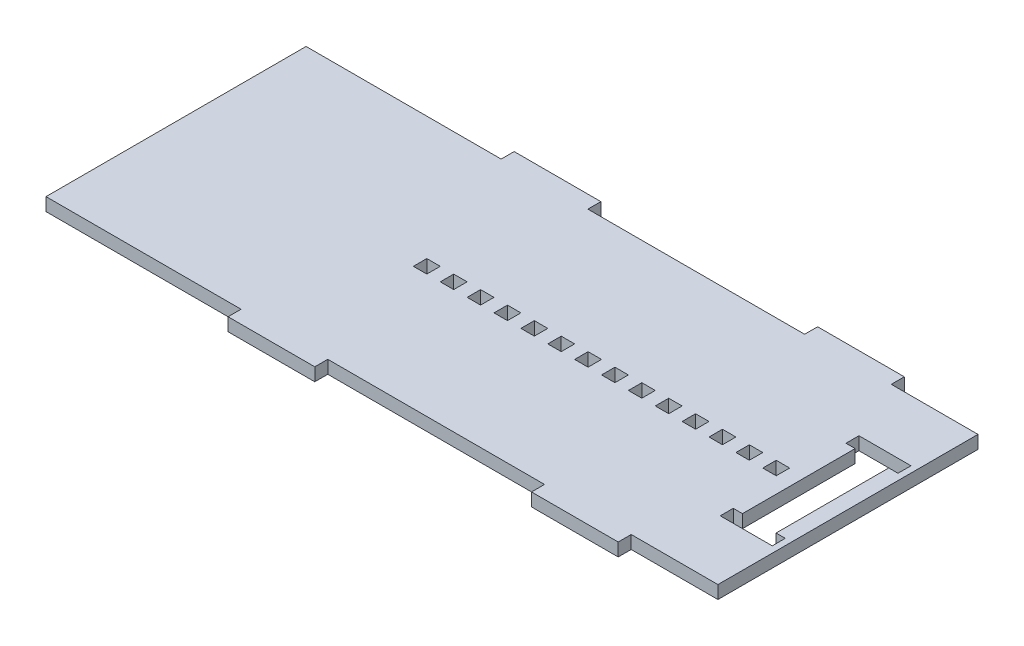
SolidWorks part; units mm, degrees
ref_plane "Front Plane" through (0, 0, 0) normal (0, 0, 1) x (1, 0, 0)
ref_plane "Top Plane" through (0, 0, 0) normal (0, 1, 0) x (1, 0, 0)
ref_plane "Right Plane" through (0, 0, 0) normal (1, 0, 0) x (0, 0, -1)
sketch "Sketch1" plane through (0, 0, 0) normal (0, 1, 0) x (1, 0, 0)
  line L1 (-65, 30) -> (65, 30)
  line L2 (-65, 30) -> (-65, -30)
  line L3 (-65, -30) -> (65, -30)
  line L4 (65, 30) -> (65, -30)
  line L5 (-65, 30) -> (65, -30) construction
  line L6 (-65, -30) -> (65, 30) construction
  point P0 (0, 0)
  dimension "D1" = 60
  dimension "D2" = 130
extrude "Boss-Extrude1" add sketch "Sketch1" along normal blind 3
sketch "Sketch2" plane through (0, 0, 0) normal (0, 1, 0) x (1, 0, 0)
  line L0 (35, 30) -> (35, 31.5) construction
  line L1 (65, 30) -> (-65, 30) construction
  line L2 (65, -30) -> (65, 30) construction
  line L3 (25, 33) -> (45, 33)
  line L4 (25, 33) -> (25, 30)
  line L5 (25, 30) -> (45, 30)
  line L6 (45, 33) -> (45, 30)
  line L7 (25, 33) -> (45, 30) construction
  line L8 (25, 30) -> (45, 33) construction
  line L9 (-35, 30) -> (-35, 31.5) construction
  line L10 (0, 0) -> (10.9135, 0) construction
  line L11 (-45, 33) -> (-25, 33)
  line L12 (-45, 33) -> (-45, 30)
  line L13 (-45, 30) -> (-25, 30)
  line L14 (-25, 33) -> (-25, 30)
  line L15 (-45, 33) -> (-25, 30) construction
  line L16 (-45, 30) -> (-25, 33) construction
  line L17 (-45, -30) -> (-25, -33) construction
  line L18 (-45, -33) -> (-25, -30) construction
  line L19 (-35, -30) -> (-35, -31.5) construction
  line L20 (25, -30) -> (45, -33) construction
  line L21 (25, -33) -> (45, -30) construction
  line L22 (35, -30) -> (35, -31.5) construction
  line L23 (-25, -33) -> (-25, -30)
  line L24 (-45, -30) -> (-25, -30)
  line L25 (-45, -33) -> (-45, -30)
  line L26 (-45, -33) -> (-25, -33)
  line L27 (45, -33) -> (45, -30)
  line L28 (25, -30) -> (45, -30)
  line L29 (25, -33) -> (25, -30)
  line L30 (25, -33) -> (45, -33)
  dimension "D1" = 20
  dimension "D2" = 3
  dimension "D3" = 20
  dimension "D4" = 50
extrude "Boss-Extrude2" add sketch "Sketch2" along normal blind 3
sketch "Sketch3" plane through (0, 0, 0) normal (0, 1, 0) x (1, 0, 0)
  line L0 (-65, 30) -> (-65, -30)
  line L1 (-65, 30) -> (-90, 30)
  line L2 (-65, -30) -> (-90, -30)
  line L3 (-90, 30) -> (-90, -30)
  dimension "D1" = 25
extrude "Boss-Extrude3" add sketch "Sketch3" along normal blind 3
sketch "Sketch4" plane through (0, 0, 0) normal (0, 1, 0) x (1, 0, 0)
  line L0 (-90, 0) -> (65, 0) construction
  line L1 (-90, 30) -> (-90, -30) construction
  line L2 (65, -30) -> (65, 30) construction
  line L3 (40.7, 1.55) -> (43.8, 1.55)
  line L4 (46.9, 1.55) -> (50, 1.55)
  line L5 (46.9, 1.55) -> (46.9, -1.55)
  line L6 (46.9, -1.55) -> (50, -1.55)
  line L7 (50, 1.55) -> (50, -1.55)
  line L8 (46.9, 1.55) -> (50, -1.55) construction
  line L9 (46.9, -1.55) -> (50, 1.55) construction
  line L10 (40.7, 1.55) -> (40.7, -1.55)
  line L11 (40.7, -1.55) -> (43.8, -1.55)
  line L12 (43.8, 1.55) -> (43.8, -1.55)
  line L13 (40.7, 1.55) -> (43.8, -1.55) construction
  line L14 (40.7, -1.55) -> (43.8, 1.55) construction
  line L15 (34.5, 1.55) -> (37.6, 1.55)
  line L16 (34.5, 1.55) -> (34.5, -1.55)
  line L17 (34.5, -1.55) -> (37.6, -1.55)
  line L18 (37.6, 1.55) -> (37.6, -1.55)
  line L19 (34.5, 1.55) -> (37.6, -1.55) construction
  line L20 (34.5, -1.55) -> (37.6, 1.55) construction
  line L21 (28.3, 1.55) -> (31.4, 1.55)
  line L22 (28.3, 1.55) -> (28.3, -1.55)
  line L23 (28.3, -1.55) -> (31.4, -1.55)
  line L24 (31.4, 1.55) -> (31.4, -1.55)
  line L25 (28.3, 1.55) -> (31.4, -1.55) construction
  line L26 (28.3, -1.55) -> (31.4, 1.55) construction
  line L27 (22.1, 1.55) -> (25.2, 1.55)
  line L28 (22.1, 1.55) -> (22.1, -1.55)
  line L29 (22.1, -1.55) -> (25.2, -1.55)
  line L30 (25.2, 1.55) -> (25.2, -1.55)
  line L31 (22.1, 1.55) -> (25.2, -1.55) construction
  line L32 (22.1, -1.55) -> (25.2, 1.55) construction
  line L33 (15.9, 1.55) -> (19, 1.55)
  line L34 (15.9, 1.55) -> (15.9, -1.55)
  line L35 (15.9, -1.55) -> (19, -1.55)
  line L36 (19, 1.55) -> (19, -1.55)
  line L37 (15.9, 1.55) -> (19, -1.55) construction
  line L38 (15.9, -1.55) -> (19, 1.55) construction
  line L39 (9.7, 1.55) -> (12.8, 1.55)
  line L40 (9.7, 1.55) -> (9.7, -1.55)
  line L41 (9.7, -1.55) -> (12.8, -1.55)
  line L42 (12.8, 1.55) -> (12.8, -1.55)
  line L43 (9.7, 1.55) -> (12.8, -1.55) construction
  line L44 (9.7, -1.55) -> (12.8, 1.55) construction
  line L45 (3.5, 1.55) -> (6.6, 1.55)
  line L46 (3.5, 1.55) -> (3.5, -1.55)
  line L47 (3.5, -1.55) -> (6.6, -1.55)
  line L48 (6.6, 1.55) -> (6.6, -1.55)
  line L49 (3.5, 1.55) -> (6.6, -1.55) construction
  line L50 (3.5, -1.55) -> (6.6, 1.55) construction
  line L51 (-2.7, 1.55) -> (0.4, 1.55)
  line L52 (-2.7, 1.55) -> (-2.7, -1.55)
  line L53 (-2.7, -1.55) -> (0.4, -1.55)
  line L54 (0.4, 1.55) -> (0.4, -1.55)
  line L55 (-2.7, 1.55) -> (0.4, -1.55) construction
  line L56 (-2.7, -1.55) -> (0.4, 1.55) construction
  line L57 (-8.9, 1.55) -> (-5.8, 1.55)
  line L58 (-8.9, 1.55) -> (-8.9, -1.55)
  line L59 (-8.9, -1.55) -> (-5.8, -1.55)
  line L60 (-5.8, 1.55) -> (-5.8, -1.55)
  line L61 (-8.9, 1.55) -> (-5.8, -1.55) construction
  line L62 (-8.9, -1.55) -> (-5.8, 1.55) construction
  line L63 (-15.1, 1.55) -> (-12, 1.55)
  line L64 (-15.1, 1.55) -> (-15.1, -1.55)
  line L65 (-15.1, -1.55) -> (-12, -1.55)
  line L66 (-12, 1.55) -> (-12, -1.55)
  line L67 (-15.1, 1.55) -> (-12, -1.55) construction
  line L68 (-15.1, -1.55) -> (-12, 1.55) construction
  line L69 (-21.3, 1.55) -> (-18.2, 1.55)
  line L70 (-21.3, 1.55) -> (-21.3, -1.55)
  line L71 (-21.3, -1.55) -> (-18.2, -1.55)
  line L72 (-18.2, 1.55) -> (-18.2, -1.55)
  line L73 (-21.3, 1.55) -> (-18.2, -1.55) construction
  line L74 (-21.3, -1.55) -> (-18.2, 1.55) construction
  line L75 (-27.5, 1.55) -> (-24.4, 1.55)
  line L76 (-27.5, 1.55) -> (-27.5, -1.55)
  line L77 (-27.5, -1.55) -> (-24.4, -1.55)
  line L78 (-24.4, 1.55) -> (-24.4, -1.55)
  line L79 (-27.5, 1.55) -> (-24.4, -1.55) construction
  line L80 (-27.5, -1.55) -> (-24.4, 1.55) construction
  line L81 (-33.7, 1.55) -> (-30.6, 1.55)
  line L82 (-33.7, 1.55) -> (-33.7, -1.55)
  line L83 (-33.7, -1.55) -> (-30.6, -1.55)
  line L84 (-30.6, 1.55) -> (-30.6, -1.55)
  line L85 (-33.7, 1.55) -> (-30.6, -1.55) construction
  line L86 (-33.7, -1.55) -> (-30.6, 1.55) construction
  line L135 (-39.9, 1.55) -> (-36.8, 1.55)
  line L136 (-39.9, 1.55) -> (-39.9, -1.55)
  line L137 (-39.9, -1.55) -> (-36.8, -1.55)
  line L138 (-36.8, 1.55) -> (-36.8, -1.55)
  line L139 (-46.1, 1.55) -> (-43, 1.55)
  line L140 (-46.1, 1.55) -> (-46.1, -1.55)
  line L141 (-46.1, -1.55) -> (-43, -1.55)
  line L142 (-43, 1.55) -> (-43, -1.55)
  line L143 (-52.3, 1.55) -> (-49.2, 1.55)
  line L144 (-52.3, 1.55) -> (-52.3, -1.55)
  line L145 (-52.3, -1.55) -> (-49.2, -1.55)
  line L146 (-49.2, 1.55) -> (-49.2, -1.55)
  line L147 (-58.5, 1.55) -> (-55.4, 1.55)
  line L148 (-58.5, 1.55) -> (-58.5, -1.55)
  line L149 (-58.5, -1.55) -> (-55.4, -1.55)
  line L150 (-55.4, 1.55) -> (-55.4, -1.55)
  line L151 (-64.7, 1.55) -> (-61.6, 1.55)
  line L152 (-64.7, 1.55) -> (-64.7, -1.55)
  line L153 (-64.7, -1.55) -> (-61.6, -1.55)
  line L154 (-61.6, 1.55) -> (-61.6, -1.55)
  line L155 (-70.9, 1.55) -> (-67.8, 1.55)
  line L156 (-70.9, 1.55) -> (-70.9, -1.55)
  line L157 (-70.9, -1.55) -> (-67.8, -1.55)
  line L158 (-67.8, 1.55) -> (-67.8, -1.55)
  line L159 (-77.1, 1.55) -> (-74, 1.55)
  line L160 (-77.1, 1.55) -> (-77.1, -1.55)
  line L161 (-77.1, -1.55) -> (-74, -1.55)
  line L162 (-74, 1.55) -> (-74, -1.55)
  line L163 (-83.3, 1.55) -> (-80.2, 1.55)
  line L164 (-83.3, 1.55) -> (-83.3, -1.55)
  line L165 (-83.3, -1.55) -> (-80.2, -1.55)
  line L166 (-80.2, 1.55) -> (-80.2, -1.55)
  line L167 (-39.9, 1.55) -> (-36.8, -1.55) construction
  line L168 (-39.9, -1.55) -> (-36.8, 1.55) construction
  line L169 (-46.1, 1.55) -> (-43, -1.55) construction
  line L170 (-46.1, -1.55) -> (-43, 1.55) construction
  line L171 (-52.3, 1.55) -> (-49.2, -1.55) construction
  line L172 (-52.3, -1.55) -> (-49.2, 1.55) construction
  line L173 (-58.5, 1.55) -> (-55.4, -1.55) construction
  line L174 (-58.5, -1.55) -> (-55.4, 1.55) construction
  line L175 (-64.7, 1.55) -> (-61.6, -1.55) construction
  line L176 (-64.7, -1.55) -> (-61.6, 1.55) construction
  line L177 (-70.9, 1.55) -> (-67.8, -1.55) construction
  line L178 (-70.9, -1.55) -> (-67.8, 1.55) construction
  line L179 (-77.1, 1.55) -> (-74, -1.55) construction
  line L180 (-77.1, -1.55) -> (-74, 1.55) construction
  line L181 (-83.3, 1.55) -> (-80.2, -1.55) construction
  line L182 (-83.3, -1.55) -> (-80.2, 1.55) construction
  point P6 (48.45, 0)
  point P11 (-81.75, 0)
  point P12 (42.25, 0)
  point P17 (36.05, 0)
  point P22 (29.85, 0)
  point P27 (23.65, 0)
  point P32 (17.45, 0)
  point P37 (11.25, 0)
  point P42 (5.05, 0)
  point P47 (-1.15, 0)
  point P52 (-7.35, 0)
  point P57 (-13.55, 0)
  point P62 (-19.75, 0)
  point P67 (-25.95, 0)
  point P72 (-32.15, 0)
  point P78 (-75.55, 0)
  point P79 (-69.35, 0)
  point P80 (-63.15, 0)
  point P81 (-56.95, 0)
  point P82 (-38.35, 0)
  point P83 (-50.75, 0)
  point P84 (-44.55, 0)
  dimension "D1" = 3.1
  dimension "D2" = 3.1
  dimension "D3" = 15
  dimension "D4" = 22
extrude "Cut-Extrude1" cut sketch "Sketch4" along normal blind 10
sketch "Sketch5" plane through (0, 0, 0) normal (0, 1, 0) x (1, 0, 0)
  line L0 (65, 16) -> (65, -16) construction
  line L1 (65, -30) -> (65, 30) construction
  line L2 (65, 16) -> (51.54, 16) construction
  line L3 (65, 0) -> (60.6424, 0) construction
  line L4 (51.54, 16) -> (63.54, 16)
  line L5 (51.54, 16) -> (51.54, 13)
  line L6 (51.54, 13) -> (63.54, 13)
  line L7 (63.54, 16) -> (63.54, 13)
  line L8 (65, -16) -> (51.54, -16) construction
  line L9 (63.54, -16) -> (63.54, -13)
  line L10 (51.54, -13) -> (63.54, -13)
  line L11 (51.54, -16) -> (51.54, -13)
  line L12 (51.54, -16) -> (63.54, -16)
  point P2 (65, 0)
  point P3 (65, 0)
  dimension "D1" = 32
  dimension "D2" = 12
  dimension "D3" = 3
  dimension "D4" = 1.46
extrude "Cut-Extrude2" cut sketch "Sketch5" along normal blind 10
sketch "Sketch6" plane through (0, 0, 0) normal (0, 1, 0) x (1, 0, 0)
  line L0 (65, 0) -> (57.54, 0) construction
  line L1 (65, -30) -> (65, 30) construction
  line L2 (57.54, 13) -> (57.54, 0) construction
  line L3 (53.667, 13) -> (61.413, 13)
  line L4 (53.667, 13) -> (53.667, -13)
  line L5 (53.667, -13) -> (61.413, -13)
  line L6 (61.413, 13) -> (61.413, -13)
  line L7 (53.667, 13) -> (61.413, -13) construction
  line L8 (53.667, -13) -> (61.413, 13) construction
  line L10 (63.54, 13) -> (51.54, 13) construction
  dimension "D1" = 26
  dimension "D2" = 7.746
extrude "Cut-Extrude3" cut sketch "Sketch6" along normal blind 10
